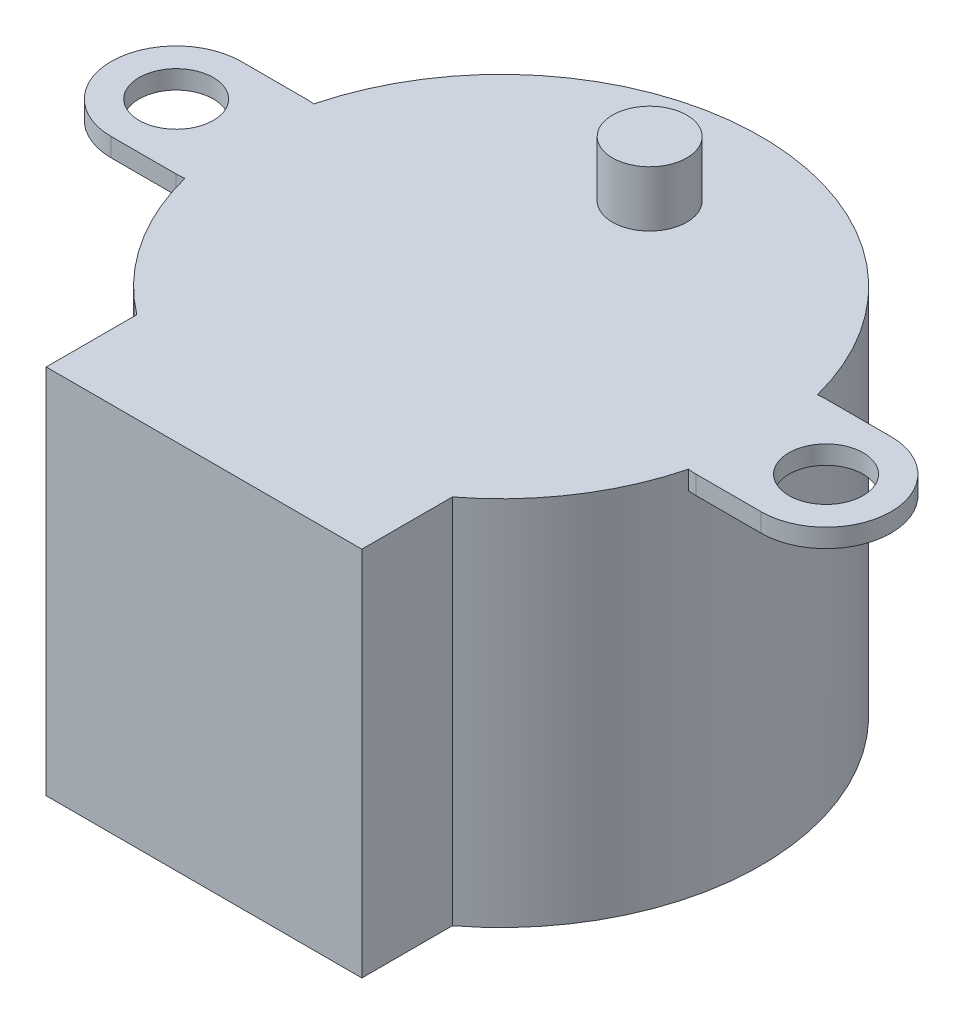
SolidWorks part; units mm, degrees
ref_plane "Front Plane" through (0, 0, 0) normal (0, 0, 1) x (1, 0, 0)
ref_plane "Top Plane" through (0, 0, 0) normal (0, 1, 0) x (1, 0, 0)
ref_plane "Right Plane" through (0, 0, 0) normal (1, 0, 0) x (0, 0, -1)
sketch "Sketch1" plane through (0, 0, 0) normal (0, 1, 0) x (1, 0, 0)
  line L1 (-8.5, -11.1243) -> (8.5, -11.1243)
  line L2 (-8.5, -11.1243) -> (-8.5, -16)
  line L3 (-8.5, -16) -> (8.5, -16)
  line L4 (8.5, -11.1243) -> (8.5, -16)
  circle A0 centre (0, 0) radius 14
  point P8 (0, -14)
  dimension "D1" = 28
  dimension "D2" = 17
  dimension "D3" = 2
extrude "Boss-Extrude1" add sketch "Sketch1" along normal blind 20 contours L1 A0 | A0 L2 L3 L4 | L1 A0
sketch "Sketch2" plane through (0, 20, 0) normal (0, 1, 0) x (1, 0, 0)
  line L0 (-14, 0) -> (14, 0) construction
  line L1 (14, 0) -> (17.5, 0) construction
  line L2 (14, 3.5) -> (17.5, 3.5)
  line L3 (14, -3.5) -> (17.5, -3.5)
  line L4 (0, 0) -> (0, 14) construction
  line L5 (-14, 0) -> (-17.5, 0) construction
  line L6 (-14, 3.5) -> (-17.5, 3.5)
  line L7 (-14, -3.5) -> (-17.5, -3.5)
  arc A0 (8.5, -11.1243) -> (-8.5, -11.1243) centre (0, 0) ccw construction
  arc A1 (14, 3.5) -> (14, -3.5) centre (14, 0) ccw
  arc A2 (17.5, -3.5) -> (17.5, 3.5) centre (17.5, 0) ccw
  circle A3 centre (17.5, 0) radius 2
  circle A4 centre (-17.5, 0) radius 2
  arc A5 (-14, 3.5) -> (-14, -3.5) centre (-14, 0) cw
  arc A6 (-17.5, -3.5) -> (-17.5, 3.5) centre (-17.5, 0) cw
  point P6 (15.75, 0)
  point P19 (-15.75, 0)
  dimension "D2" = 3.5
  dimension "D3" = 4
  dimension "D1" = 3.5
extrude "Boss-Extrude2" add sketch "Sketch2" against normal blind 1
sketch "Sketch3" plane through (0, 20, 0) normal (0, 1, 0) x (1, 0, 0)
  line L0 (0, 0) -> (0, 14) construction
  arc A0 (13.5625, 3.4725) -> (-13.5625, 3.4725) centre (0, 0) ccw construction
  circle A1 centre (0, 8) radius 2
  dimension "D1" = 6
extrude "Boss-Extrude3" add sketch "Sketch3" along normal blind 3
